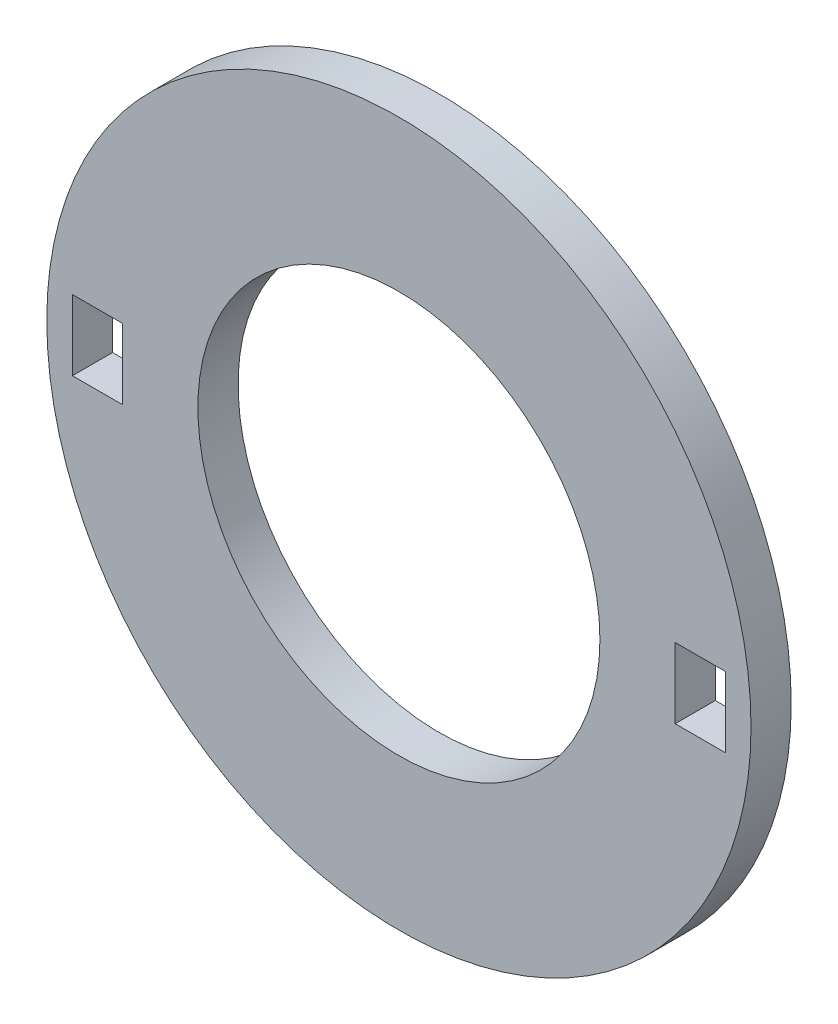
SolidWorks part; units mm, degrees
ref_plane "Front Plane" through (0, 0, 0) normal (0, 0, 1) x (1, 0, 0)
ref_plane "Top Plane" through (0, 0, 0) normal (0, 1, 0) x (1, 0, 0)
ref_plane "Right Plane" through (0, 0, 0) normal (1, 0, 0) x (0, 0, -1)
sketch "Sketch1" plane through (0, 0, 0) normal (0, 0, 1) x (1, 0, 0)
  line L0 (27.4843, -3.5) -> (27.4843, 3.5)
  line L1 (-32.4843, 3.5) -> (-27.4843, 3.5)
  line L2 (-32.4843, 3.5) -> (-32.4843, -3.5)
  line L3 (-32.4843, -3.5) -> (-27.4843, -3.5)
  line L4 (-27.4843, 3.5) -> (-27.4843, -3.5)
  line L5 (-32.4843, 3.5) -> (-27.4843, -3.5) construction
  line L6 (-32.4843, -3.5) -> (-27.4843, 3.5) construction
  line L7 (32.4843, 3.5) -> (27.4843, 3.5)
  line L8 (32.4843, -3.5) -> (32.4843, 3.5)
  line L9 (32.4843, -3.5) -> (27.4843, -3.5)
  circle A1 centre (0, 0) radius 20
  circle A2 centre (0, 0) radius 35.0334
  point P17 (0, 0)
  dimension "D4" = 32.4843
  dimension "D5" = 2
  dimension "D2" = 5
  dimension "D3" = 7
extrude "Boss-Extrude6" add sketch "Sketch1" along normal blind 4
